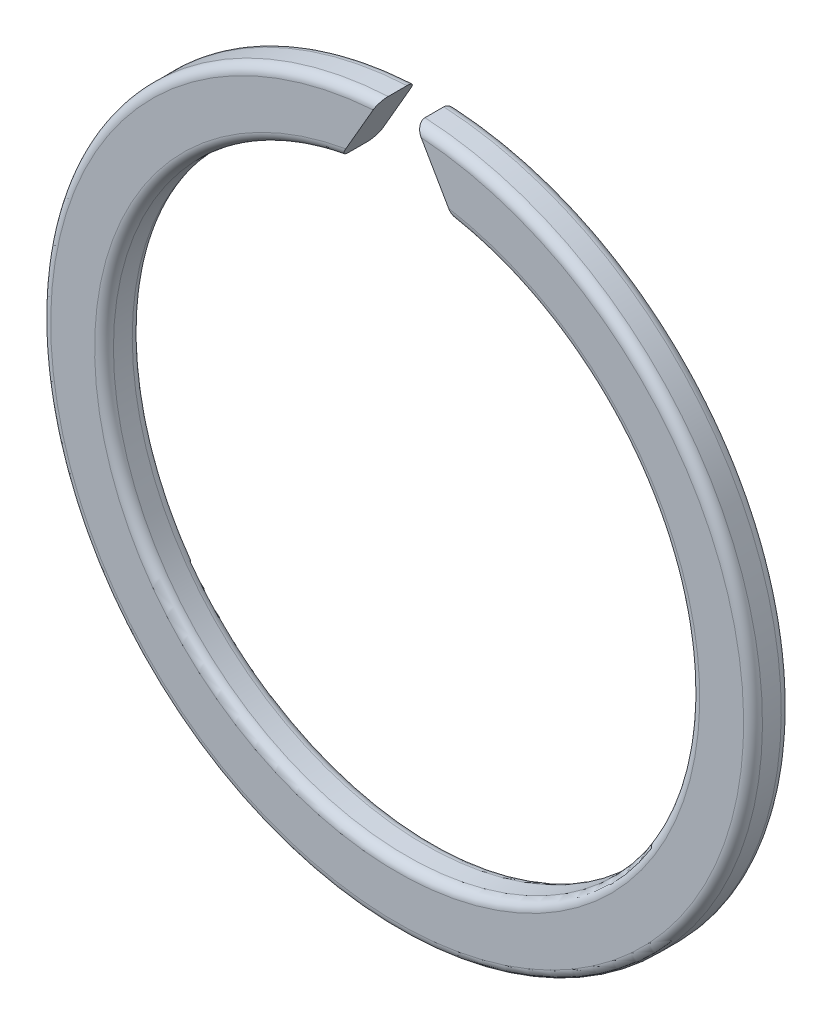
SolidWorks part; units mm, degrees
ref_plane "Front Plane" through (0, 0, 0) normal (0, 0, 1) x (1, 0, 0)
ref_plane "Top Plane" through (0, 0, 0) normal (0, 1, 0) x (1, 0, 0)
ref_plane "Right Plane" through (0, 0, 0) normal (1, 0, 0) x (0, 0, -1)
other "Configuration Table"
sketch "BodySke" plane through (0, 0, 0) normal (0, 0, 1) x (1, 0, 0)
  circle A0 centre (0, 0) radius 9.35
  circle A1 centre (0, 0) radius 11.35
extrude "BaseBody" add sketch "BodySke" along normal blind 1.2
sketch "SlitSke" plane through (0, 0, 0) normal (0, 0, 1) x (1, 0, 0)
  line L0 (0, 0) -> (0, 17.3673) construction
  line L1 (0, 12.35) -> (-1.8373, 9.1677)
  line L2 (-1.8373, 9.1677) -> (1.8373, 9.1677)
  line L3 (0, 12.35) -> (1.8373, 9.1677)
  circle A0 centre (0, 0) radius 9.35 construction
  point P9 (0, 9.1677)
extrude "Slit" cut sketch "SlitSke" along normal through all
fillet "Fillet1" radius 0.3 4 edges at (0, -9.35, 0) (0, -11.35, 0) (0, -9.35, 1.2) (0, -11.35, 1.2)
equation "\"D2@SlitSke\" = \"Groove_Diameter@BodySke\" / 2 + \"Groove_Width@BodySke\" * 1.5"
